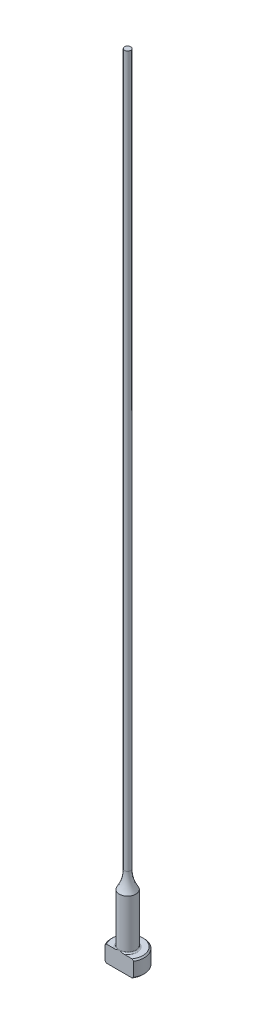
SolidWorks part; units mm, degrees
ref_plane "Front Plane" through (0, 0, 0) normal (0, 0, 1) x (1, 0, 0)
ref_plane "Top Plane" through (0, 0, 0) normal (0, 1, 0) x (1, 0, 0)
ref_plane "Right Plane" through (0, 0, 0) normal (1, 0, 0) x (0, 0, -1)
sketch "Sketch1" plane through (0, 0, 0) normal (0, 0, 1) x (1, 0, 0)
  line L0 (0, 259.9588) -> (0, -15.1925) construction
  line L1 (0, 0) -> (-3.175, 0)
  line L2 (-3.175, 0) -> (-3.175, 3.175)
  line L3 (-3.175, 3.175) -> (-1.5875, 3.175)
  line L4 (-0.5944, 16.1098) -> (-0.5944, 152.4)
  line L5 (-0.5944, 152.4) -> (0, 152.4)
  line L6 (0, 152.4) -> (0, 0)
  line L7 (-1.5875, 3.175) -> (-1.5875, 12.7)
  arc A0 (-1.5875, 12.7) -> (-0.5944, 16.1098) centre (-6.9444, 16.1098) ccw
  point P13 (-1.5875, 0)
  dimension "D1" = 6.35
  dimension "L" = 152.4
  dimension "D2" = 3.175
  dimension "H" = 6.35
  dimension "T" = 3.175
  dimension "D" = 1.1887
  dimension "S" = 12.7
revolve "Revolve1" add sketch "Sketch1" angle 360 about L0
chamfer "Chamfer1" distance 0.254 angle 45 2 edges at (0, 3.175, 3.175) (0, 0, 3.175)
fillet "Fillet1" radius 0.254 1 edges at (0, 3.175, 1.5875)
sketch "Sketch2" plane through (0, 0, 0) normal (0, -1, 0) x (1, 0, 0)
  line L0 (-2.7496, 1.5875) -> (2.7496, 1.5875)
  circle A0 centre (0, 0) radius 3.175 construction
  arc A1 (2.7496, 1.5875) -> (-2.7496, 1.5875) centre (0, 0) ccw
  circle A4 centre (0, 0) radius 1.5875 construction
  dimension "D1" = 0
extrude "KEY" cut sketch "Sketch2" against normal through all
